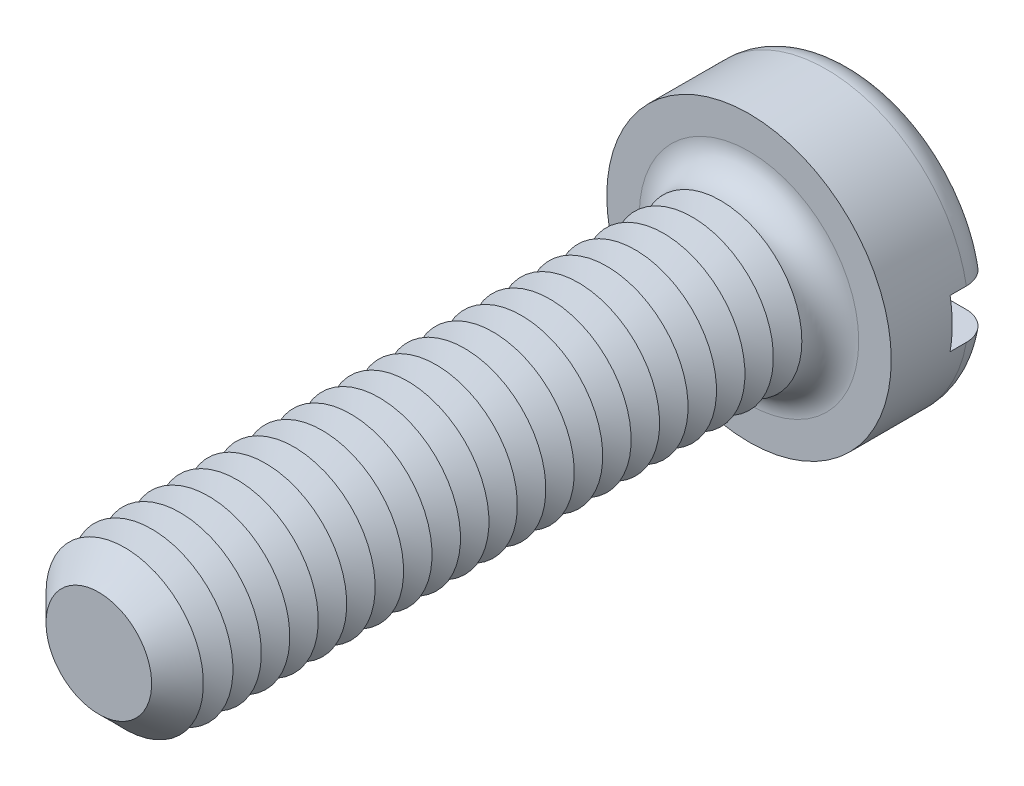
SolidWorks part; units mm, degrees
ref_plane "Front Plane" through (0, 0, 0) normal (0, 0, 1) x (1, 0, 0)
ref_plane "Top Plane" through (0, 0, 0) normal (0, 1, 0) x (1, 0, 0)
ref_plane "Right Plane" through (0, 0, 0) normal (1, 0, 0) x (0, 0, -1)
sketch "Sketch3" plane through (0, 0, 0) normal (0, 0, 1) x (1, 0, 0)
  circle A0 centre (0, 0) radius 3.5
  dimension "D1" = 7
extrude "Boss-Extrude2" add sketch "Sketch3" against normal blind 2.6
sketch "Sketch4" plane through (0, 0, 0) normal (0, 0, 1) x (1, 0, 0)
  circle A0 centre (0, 0) radius 2
  dimension "D1" = 4
extrude "Boss-Extrude3" add sketch "Sketch4" along normal blind 16
fillet "Fillet1" radius 0.7 2 edges at (3.5, 0, -2.6) (2, 0, 0)
chamfer "Chamfer1" distance 0.7 angle 45 1 edges at (2, 0, 16)
sketch "Sketch5" plane through (0, 0, 0) normal (1, 0, 0) x (0, 0, -1)
  line L0 (1.6944, 0) -> (-7.6738, 0) construction
sketch "Sketch6" plane through (0, 0, 0) normal (1, 0, 0) x (0, 0, -1)
  line L0 (-0.7, 2) -> (-1.05, 1.3938)
  line L1 (-1.05, 1.3938) -> (-1.4, 2)
  line L2 (-0.7, 2) -> (-15.3, 2) construction
  line L3 (-1.4, 2) -> (-0.7, 2)
  dimension "D1" = 0.7
revolve "Cut-Revolve1" cut sketch "Sketch6" angle 360 about L0
pattern_linear "LPattern1" count 21 spacing 0.7 along (0, 0, 1) of "Cut-Revolve1"
sketch "Sketch8" plane through (0, 0, -2.6) normal (0, 0, -1) x (-1, 0, 0)
  line L1 (3.5, -0.6) -> (-3.5, -0.6)
  line L2 (3.5, -0.6) -> (3.5, 0.6)
  line L3 (3.5, 0.6) -> (-3.5, 0.6)
  line L4 (-3.5, -0.6) -> (-3.5, 0.6)
  line L5 (3.5, -0.6) -> (-3.5, 0.6) construction
  line L6 (3.5, 0.6) -> (-3.5, -0.6) construction
  point P0 (0, 0)
  dimension "D1" = 7
  dimension "D2" = 1.2
extrude "Cut-Extrude1" cut sketch "Sketch8" against normal blind 1.1
